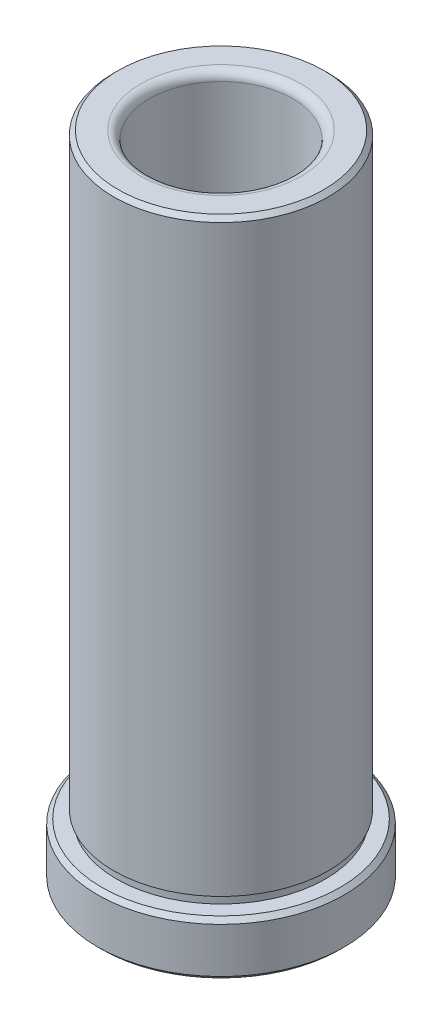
SolidWorks part; units mm, degrees
ref_plane "Front Plane" through (0, 0, 0) normal (0, 0, 1) x (1, 0, 0)
ref_plane "Top Plane" through (0, 0, 0) normal (0, 1, 0) x (1, 0, 0)
ref_plane "Right Plane" through (0, 0, 0) normal (1, 0, 0) x (0, 0, -1)
sketch "Sketch1" plane through (0, 0, 0) normal (0, 0, 1) x (1, 0, 0)
  line L0 (0, 33.4633) -> (0, -0.9295) construction
  line L1 (6.3627, 57.785) -> (6.3627, 0)
  line L2 (6.3627, 57.785) -> (9.5377, 57.785)
  line L3 (9.5377, 57.785) -> (9.5377, 5.5372)
  line L4 (9.5377, 5.5372) -> (9.2837, 5.5372)
  line L5 (9.2837, 5.5372) -> (9.2837, 4.7752)
  line L6 (9.2837, 4.7752) -> (10.9601, 4.7752)
  line L7 (10.9601, 4.7752) -> (10.9601, 0)
  line L8 (10.9601, 0) -> (6.3627, 0)
  dimension "D1" = 19.0754
  dimension "D2" = 0.254
  dimension "D3" = 0.762
  dimension "D4" = 21.9202
  dimension "D5" = 12.7254
  dimension "D6" = 4.7752
  dimension "D7" = 57.785
revolve "Revolve1" add sketch "Sketch1" angle 360 about L0
fillet "Fillet1" radius 0.762 1 edges at (0, 57.785, 6.3627)
chamfer "Chamfer1" distance 0.762 angle 45 1 edges at (0, 0, 6.3627)
chamfer "Chamfer2" distance 0.381 angle 45 3 edges at (0, 0, 10.9601) (0, 4.7752, 10.9601) (0, 57.785, 9.5377)
